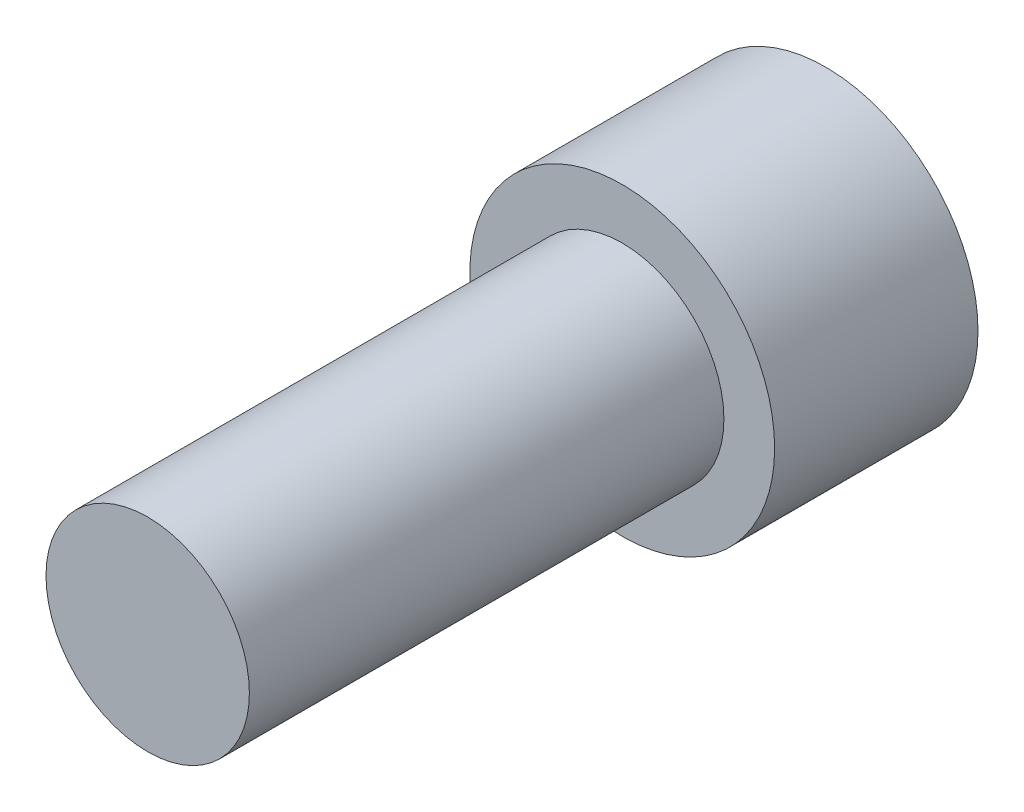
SolidWorks part; units mm, degrees
ref_plane "Front Plane" through (0, 0, 0) normal (0, 0, 1) x (1, 0, 0)
ref_plane "Top Plane" through (0, 0, 0) normal (0, 1, 0) x (1, 0, 0)
ref_plane "Right Plane" through (0, 0, 0) normal (1, 0, 0) x (0, 0, -1)
sketch "Sketch6" plane through (0, 0, 0) normal (1, 0, 0) x (0, 0, -1)
  line L0 (-22.225, 0) -> (22.525, 0) construction
  line L1 (7.8511, 0) -> (-7.8511, 0) construction
  line L2 (-22.225, 0) -> (-22.225, -4.7625)
  line L3 (-22.225, -4.7625) -> (0, -4.7625)
  line L4 (0, 7.8511) -> (0, -7.8511) construction
  line L5 (0, -4.7625) -> (0, -7.1374)
  line L6 (0, -7.1374) -> (9.525, -7.1374)
  line L7 (9.525, -7.1374) -> (9.525, 0)
  line L8 (9.525, 0) -> (-22.225, 0)
  dimension "L" = 22.225
  dimension "H" = 9.525
  dimension "A" = 14.2748
  dimension "D" = 9.525
revolve "Revolve1" add sketch "Sketch6" angle 360 about L0
sketch "Sketch7" plane through (0, 0, -9.525) normal (0, 0, -1) x (-1, 0, 0)
  line L2 (-3.9624, 2.2877) -> (-3.9624, -2.2877)
  line L4 (-3.9624, -2.2877) -> (0, -4.5754)
  line L5 (0, -4.5754) -> (3.9624, -2.2877)
  line L6 (3.9624, -2.2877) -> (3.9624, 2.2877)
  line L7 (3.9624, 2.2877) -> (0, 4.5754)
  line L8 (0, 4.5754) -> (-3.9624, 2.2877)
  circle A0 centre (0, 0) radius 3.9624 construction
  dimension "J" = 7.9248
extrude "HEX" cut sketch "Sketch7" against normal blind 5.842
